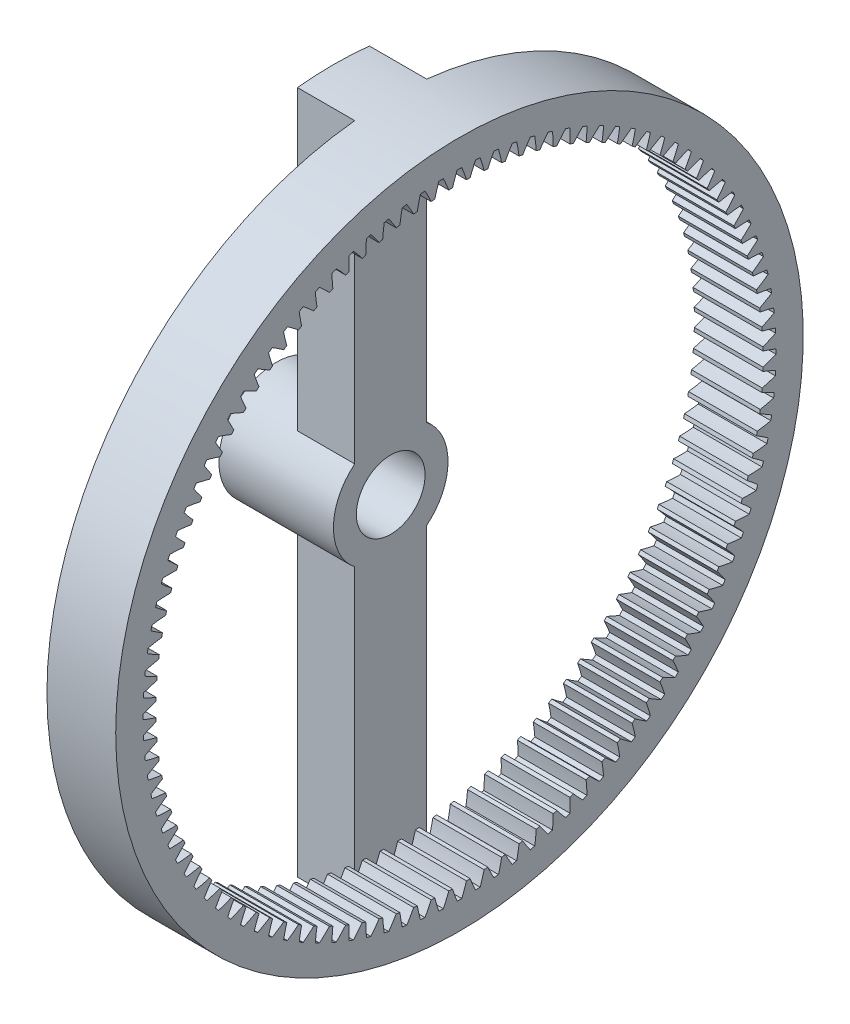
SolidWorks part; units mm, degrees
other "<Internal Spur Gear_AM>-<TeethCuts>"
ref_plane "Face" through (0, 0, 0) normal (0, 0, 1) x (1, 0, 0)
ref_plane "Dessus" through (0, 0, 0) normal (0, 1, 0) x (1, 0, 0)
ref_plane "Droite" through (0, 0, 0) normal (1, 0, 0) x (0, 0, -1)
inserted part "Internal Spur Gear_AM"
sketch "Esquisse1" plane through (0, 0, 0) normal (-1, 0, 0) x (0, 0, 1)
  line L0 (0, 0) -> (0, 64.7343) construction
  line L1 (-6.2802, 59.6704) -> (-6.2802, -59.6704)
  line L2 (6.2802, 59.6704) -> (6.2802, -59.6704)
  arc A0 (-6.2802, -59.6704) -> (6.2802, -59.6704) centre (0, 0) ccw
  arc A1 (6.2802, 59.6704) -> (-6.2802, 59.6704) centre (0, 0) ccw
extrude "Extrusion1" add sketch "Esquisse1" along normal blind 10
sketch "Esquisse3" plane through (0, 0, 0) normal (1, 0, 0) x (0, 0, -1)
  circle A0 centre (0, 0) radius 10
extrude "Extrusion2" add sketch "Esquisse3" against normal blind 20
sketch "Esquisse4" plane through (-20, 0, 0) normal (-1, 0, 0) x (0, 0, 1)
  circle A0 centre (0, 0) radius 6
extrude "Enlèv. mat.-Extru.1" cut sketch "Esquisse4" against normal through all
